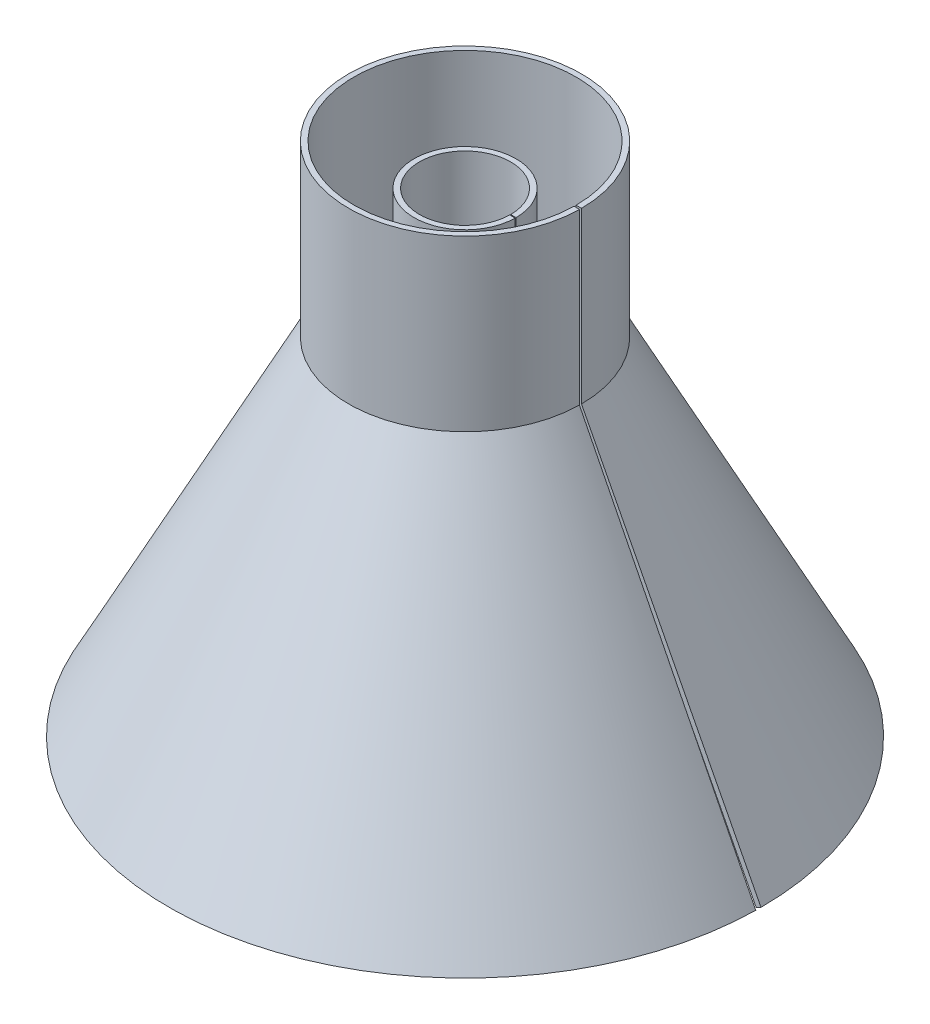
SolidWorks part; units mm, degrees
ref_plane "Front Plane" through (0, 0, 0) normal (0, 0, 1) x (1, 0, 0)
ref_plane "Top Plane" through (0, 0, 0) normal (0, 1, 0) x (1, 0, 0)
ref_plane "Right Plane" through (0, 0, 0) normal (1, 0, 0) x (0, 0, -1)
sketch "Sketch35" plane through (0, 0, 0) normal (0, 0, 1) x (1, 0, 0)
  line L0 (54.0573, 0) -> (20.6236, 64.4859)
  line L1 (0, 0) -> (0, 39.4106) construction
  line L2 (20.6236, 64.4859) -> (20.6236, 96.1903)
revolve "Revolve-Thin8" add sketch "Sketch35" angle 359 about L1
sketch "Sketch42" plane through (0, 0, 0) normal (0, 0, 1) x (1, 0, 0)
  line L0 (28.8268, 0) -> (8.4666, 63.6173)
  line L1 (0, 0) -> (0, 37.4111) construction
  line L2 (8.4666, 63.6173) -> (8.4666, 88.614)
revolve "Revolve-Thin9" add sketch "Sketch42" angle 359 about L1
